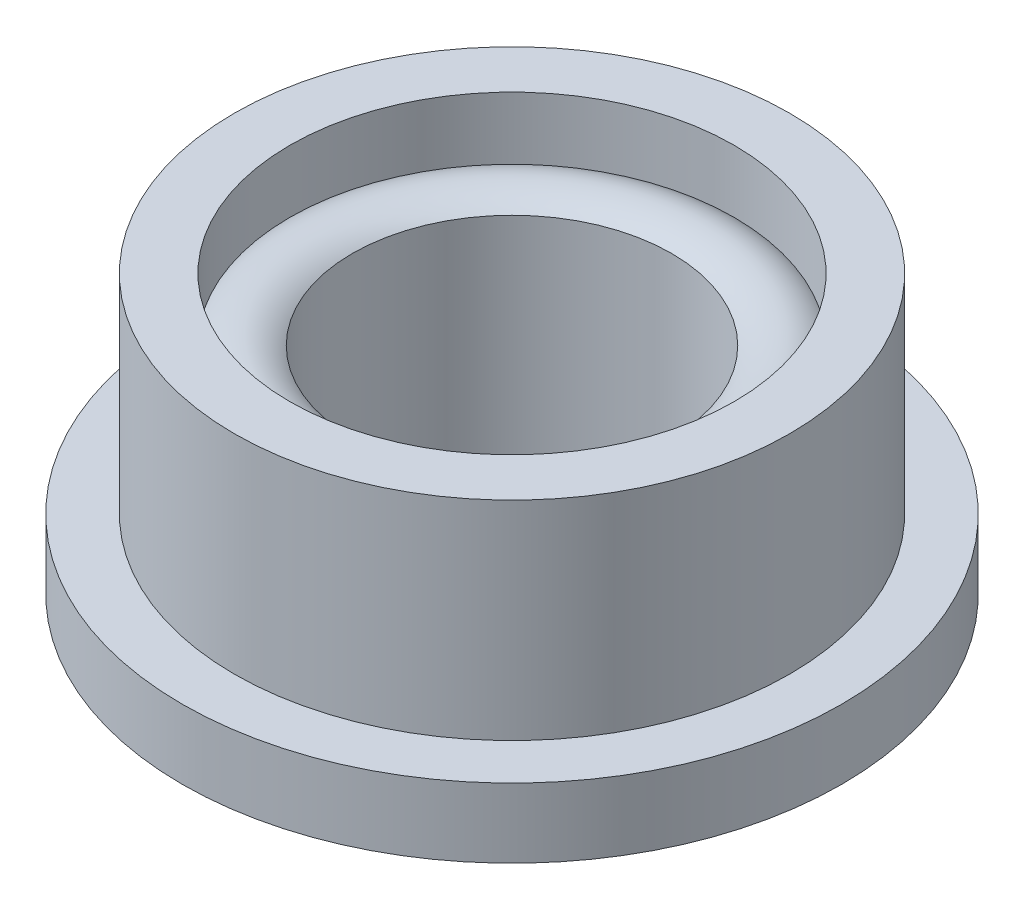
SolidWorks part; units mm, degrees
ref_plane "前视基准面" through (0, 0, 0) normal (0, 0, 1) x (1, 0, 0)
ref_plane "上视基准面" through (0, 0, 0) normal (0, 1, 0) x (1, 0, 0)
ref_plane "右视基准面" through (0, 0, 0) normal (1, 0, 0) x (0, 0, -1)
sketch "Sketch2" plane through (0, 0, 0) normal (0, 1, 0) x (1, 0, 0)
  circle A0 centre (0, 0) radius 4.75
  circle A1 centre (0, 0) radius 1.5
  dimension "D1" = 9.5
  dimension "D2" = 3
extrude "Boss-Extrude1" add sketch "Sketch2" along normal blind 1
sketch "Sketch3" plane through (0, 1, 0) normal (0, 1, 0) x (1, 0, 0)
  circle A0 centre (0, 0) radius 4
  circle A1 centre (0, 0) radius 1.5 construction
  circle A2 centre (0, 0) radius 1.5
  dimension "D1" = 8
extrude "Boss-Extrude2" add sketch "Sketch3" along normal blind 3
sketch "Sketch4" plane through (0, 4, 0) normal (0, 1, 0) x (1, 0, 0)
  circle A0 centre (0, 0) radius 2.3
  circle A1 centre (0, 0) radius 3.2
  dimension "D1" = 4.6
  dimension "D2" = 6.4
extrude "Cut-Extrude1" cut sketch "Sketch4" against normal blind 0.9
sketch "Sketch5" plane through (0, 0, 0) normal (1, 0, 0) x (0, 0, -1)
  line L2 (3.2, 3.1) -> (-3.2, 3.1) construction
  line L3 (2.3, 3.1) -> (-2.3, 3.1) construction
  line L4 (3.2, 3.1) -> (-3.2, 3.1)
  line L5 (2.3, 3.1) -> (-2.3, 3.1)
  arc A0 (-3.2, 3.1) -> (-2.3, 3.1) centre (-2.75, 2.5) cw
  point P5 (-2.75, 3.25)
  dimension "D1" = 0.15
ref_axis "Axis1" through (0, 4, 0) along (0, -1, 0)
revolve "Revolve1" add sketch "Sketch5" angle 360 about axis through (0, 4, 0) along (0, -1, 0)
sketch "Sketch6" plane through (0, 4, 0) normal (0, 1, 0) x (1, 0, 0)
  circle A0 centre (0, 0) radius 1.5 construction
  circle A1 centre (0, 0) radius 2.3 construction
  circle A2 centre (0, 0) radius 1.5
  circle A3 centre (0, 0) radius 2.3
extrude "Cut-Extrude3" cut sketch "Sketch6" against normal blind 10
